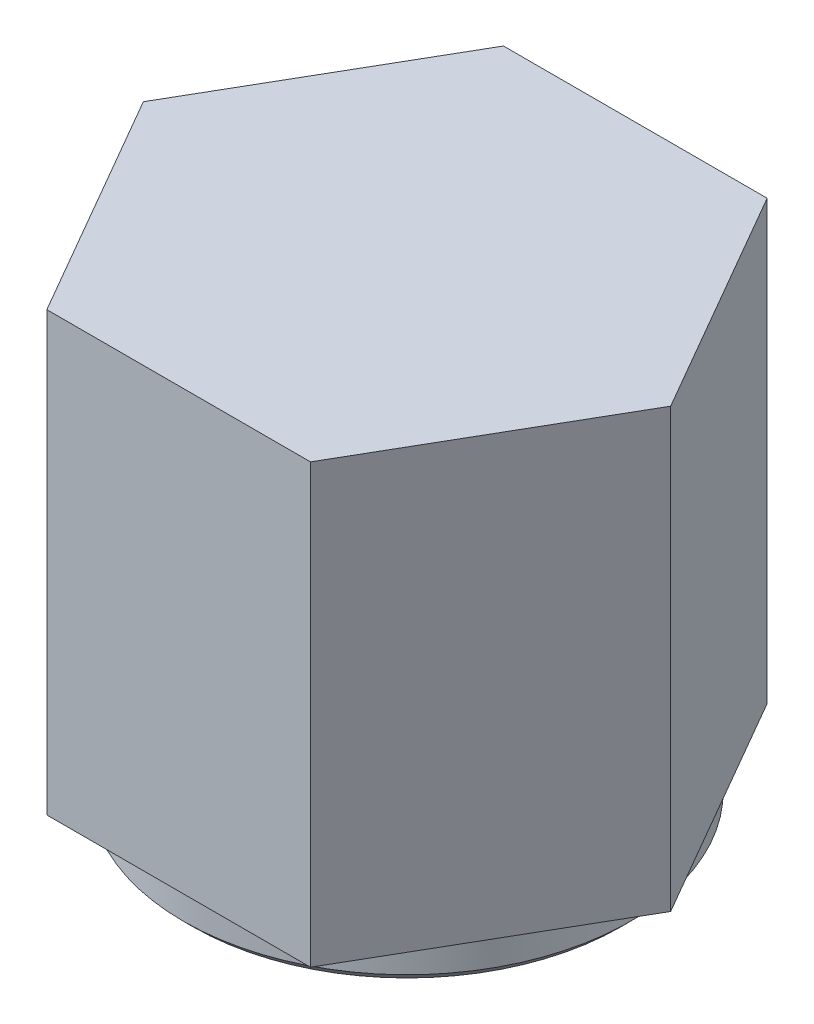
SolidWorks part; units mm, degrees
ref_plane "Přední rovina" through (0, 0, 0) normal (0, 0, 1) x (1, 0, 0)
ref_plane "Horní rovina" through (0, 0, 0) normal (0, 1, 0) x (1, 0, 0)
ref_plane "Pravá rovina" through (0, 0, 0) normal (1, 0, 0) x (0, 0, -1)
sketch "Skica1" plane through (0, 0, 0) normal (0, 1, 0) x (1, 0, 0)
  line L1 (13.8564, 0) -> (6.9282, 12)
  line L2 (6.9282, 12) -> (-6.9282, 12)
  line L3 (-6.9282, 12) -> (-13.8564, 0)
  line L4 (-13.8564, 0) -> (-6.9282, -12)
  line L5 (-6.9282, -12) -> (6.9282, -12)
  line L6 (6.9282, -12) -> (13.8564, 0)
  circle A0 centre (0, 0) radius 12 construction
extrude "Přidat vysunutím1" add sketch "Skica1" along normal blind 25
sketch "Skica2" plane through (0, 0, 0) normal (0, -1, 0) x (1, 0, 0)
  circle A0 centre (0, 0) radius 9.25
  dimension "D1" = 18.5
extrude "Odebrat vysunutím1" cut sketch "Skica2" against normal blind 18
chamfer "Zkosení1" distance 1 angle 45 1 edges at (0, 0, -9.25)
sketch "Skica3" plane through (0, 18, 0) normal (0, -1, 0) x (1, 0, 0)
  circle A0 centre (0, 0) radius 10.2
  dimension "D1" = 20.4
extrude "Odebrat vysunutím2" cut sketch "Skica3" along normal blind 5
chamfer "Zkosení2" distance 0.95 angle 45 1 edges at (0, 13, -10.2)
fillet "Zaoblit1" radius 0.5 2 edges at (0, 13.95, -10.2) (0, 18, -10.2)
hole_wizard "Ø7.0 (7) průměr díry1" positions "Skica5" profile "Skica4" hole size "Ø7.0" standard "DIN"
sketch "Skica5" plane through (0, 18, 0) normal (0, -1, 0) x (1, 0, 0)
  circle A0 centre (0, 0) radius 9.7 construction
  point P0 (0, 0)
  dimension "D1" = 0
sketch "Skica4" plane through (0, 18, 0) normal (1, 0, 0) x (0, 0, -1)
  line L0 (0, 0) -> (0, 6.0207)
  line L1 (0, 6.0207) -> (3.5, 4)
  line L2 (3.5, 4) -> (3.5, 0)
  line L5 (3.5, 0) -> (0, 0)
  line L10 (0, 6.0207) -> (-3.5, 4) construction
  line L11 (0, -6.35) -> (0, 107.95) construction
  dimension "Průměr díry" = 7
  dimension "Hloubka díry" = 4
  dimension "Úhel vrtání" = 120
sketch "Skica6" plane through (0, 0, 0) normal (0, -1, 0) x (1, 0, 0)
  circle A0 centre (0, 0) radius 11.75
  dimension "D1" = 23.5
extrude "Odebrat vysunutím3" cut sketch "Skica6" against normal blind 2 flip side to cut
chamfer "Zkosení3" distance 0.5 angle 45 1 edges at (0, 0, -11.75)
